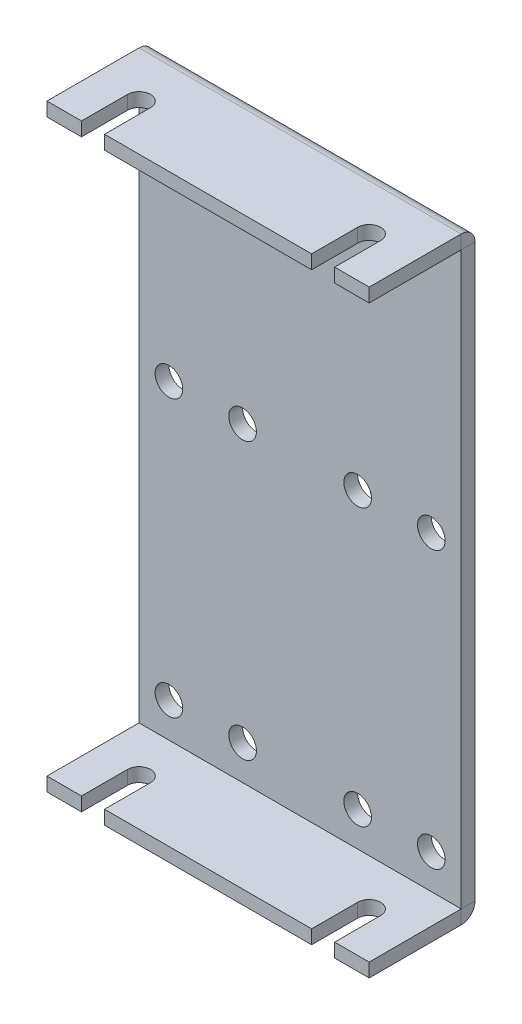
SolidWorks part; units mm, degrees
ref_plane "Alzado" through (0, 0, 0) normal (0, 0, 1) x (1, 0, 0)
ref_plane "Planta" through (0, 0, 0) normal (0, 1, 0) x (1, 0, 0)
ref_plane "Vista lateral" through (0, 0, 0) normal (1, 0, 0) x (0, 0, -1)
sketch "Croquis1" plane through (0, 0, 0) normal (1, 0, 0) x (0, 0, -1)
  line L0 (-23, 63) -> (-23, 60)
  line L1 (-23, 63) -> (0, 63)
  line L2 (-23, 60) -> (-3, 60)
  line L3 (-23, -67) -> (0, -67)
  line L4 (0, 63) -> (0, -67)
  line L5 (-23, -67) -> (-23, -64)
  line L6 (-23, -64) -> (-3, -64)
  line L7 (-3, -64) -> (-3, 60)
extrude "Extruir1" add sketch "Croquis1" along normal blind 70
sketch "Croquis2" plane through (0, 0, 0) normal (0, 0, -1) x (-1, 0, 0)
  point P0 (-63.4979, 3.5031)
  point P1 (-47.4979, 3.5031)
  point P3 (-22.4979, 3.5031)
  point P5 (-6.4979, 3.5031)
  point P7 (-6.4979, -56.4969)
  point P9 (-22.4979, -56.4969)
  point P15 (-47.4979, -56.4969)
  point P17 (-63.4979, -56.4969)
hole_wizard "Taladro de diámetro de Ø6.0 (6)2" positions "Croquis3D1" profile "Croquis5" hole size "Ø6.0" standard "ISO"
sketch3d "Croquis3D1"
  point P0 (6.4979, 3.5031, 0)
  point P3 (22.4979, 3.5031, 0)
  point P6 (47.4979, 3.5031, 0)
  point P9 (63.4979, 3.5031, 0)
  point P12 (63.4979, -56.4969, 0)
  point P15 (47.4979, -56.4969, 0)
  point P18 (22.4979, -56.4969, 0)
  point P21 (6.4979, -56.4969, 0)
sketch "Croquis5" plane through (6.4979, 3.5031, 0) normal (1, 0, 0) x (0, 1, 0)
  line L0 (0, 0) -> (0, 23)
  line L1 (0, 23) -> (3, 23)
  line L2 (3, 23) -> (3, 0)
  line L5 (3, 0) -> (0, 0)
  line L11 (0, -6.35) -> (0, 107.95) construction
  dimension "Diámetro de taladro hasta el siguiente" = 6
  dimension "Profundidad de taladro hasta el siguiente" = 23
sketch "Croquis4" plane through (0, 63, 0) normal (0, 1, 0) x (1, 0, 0)
  line L0 (7.5, -13) -> (7.5, -23)
  line L1 (70, -23) -> (0, -23) construction
  line L2 (12.5, -13) -> (12.5, -23)
  line L3 (62.5, -13) -> (62.5, -23)
  line L4 (57.5, -13) -> (57.5, -23)
  line L5 (12.5, -23) -> (57.5, -23)
  arc A0 (7.5, -13) -> (12.5, -13) centre (10, -13) cw
  arc A1 (57.5, -13) -> (62.5, -13) centre (60, -13) cw
  point P0 (10, -13)
  point P1 (60, -13)
extrude "Cortar-Extruir6" cut sketch "Croquis4" against normal through all and the other way through all flip side to cut
sheet metal parameters "Chapa metálica1" parameters "D1"=0.7366, "Espesor"=3
bend "Pliegue de arista viva2" bend angle 90 parameters "D1"=0, "D5"=1
flatten bends "Desplegar pliegues1" parameters "D1"=0
sketch "Croquis de arista viva1" plane through (0, 0, 3) normal (0, 0, 1) x (1, 0, 0)
  line L0 (70, 63) -> (0, 63) construction
  line L1 (0, -67) -> (70, -67) construction
bend "Pliegue de arista viva1" bend angle 90 parameters "D1"=0, "D5"=2
process bends "Procesar pliegues1" parameters "D1"=0
sketch "Croquis desplegado1" plane through (0, 0, 3) normal (0, 0, 1) x (1, 0, 0)
flat pattern "Chapa desplegada1"
sketch "Líneas de pliegue1" plane through (0, 0, 3) normal (0, 0, 1) x (1, 0, 0)
  line L0 (80, -67) -> (0, -67) construction
  line L1 (0, 63) -> (80, 63) construction
  line L2 (80, -67) -> (0, -67) construction
  line L3 (0, 63) -> (80, 63) construction
bend of the flat pattern "Aplanar-<Pliegue de arista viva1>1"
bend of the flat pattern "Aplanar-<Pliegue de arista viva2>1"
